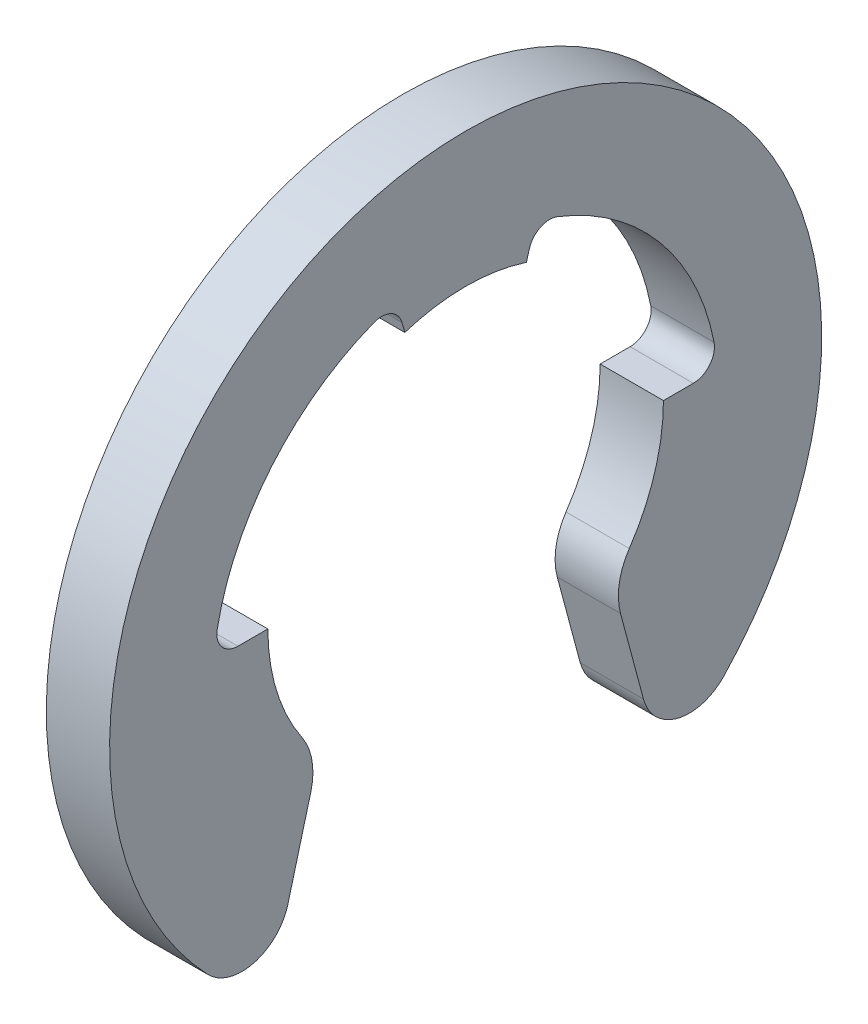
SolidWorks part; units mm, degrees
ref_plane "Plan1" through (0, 0, 0) normal (0, 0, 1) x (1, 0, 0)
ref_plane "Plan2" through (0, 0, 0) normal (0, 1, 0) x (1, 0, 0)
ref_plane "Plan3" through (0, 0, 0) normal (1, 0, 0) x (0, 0, -1)
sketch "Esquisse1" plane through (0, 0, 0) normal (1, 0, 0) x (0, 0, -1)
  line L0 (0, 0) -> (1.2452, -1.874) construction
  line L1 (0, 0) -> (0, -9.1601) construction
  line L2 (-20, 0) -> (20, 0) construction
  line L3 (0, 0) -> (0.6202, 2.1628) construction
  line L4 (-20, 0.15) -> (20, 0.15) construction
  line L5 (0.3841, 1.3395) -> (1.2452, -1.874) construction
  line L6 (0.3841, 1.3395) -> (0.4026, 1.404)
  line L7 (-1.25, 0.15) -> (-1.439, 0.15)
  line L8 (0.9789, -0.8802) -> (1.1238, -1.4209)
  line L9 (1.25, 0.15) -> (1.439, 0.15)
  line L10 (-0.9789, -0.8802) -> (-1.1238, -1.4209)
  line L11 (-0.3841, 1.3395) -> (-0.4026, 1.404)
  arc A0 (1.631, -1.5499) -> (-1.631, -1.5499) centre (0, 0) ccw
  arc A1 (1.5699, 0.3091) -> (0.579, 1.4916) centre (0, 0) ccw
  arc A2 (0.3841, 1.3395) -> (-0.3841, 1.3395) centre (0, 0.15) ccw
  arc A3 (1.25, 0.15) -> (1.0343, -0.552) centre (0, 0.15) cw
  arc A4 (1.631, -1.5499) -> (1.1238, -1.4209) centre (1.4135, -1.3433) cw
  arc A5 (0.579, 1.4916) -> (0.4026, 1.404) centre (0.5308, 1.3673) ccw
  arc A6 (1.5699, 0.3091) -> (1.439, 0.15) centre (1.439, 0.2833) cw
  arc A7 (-1.5699, 0.3091) -> (-1.439, 0.15) centre (-1.439, 0.2833) ccw
  arc A8 (-0.579, 1.4916) -> (-0.4026, 1.404) centre (-0.5308, 1.3673) cw
  arc A9 (-1.631, -1.5499) -> (-1.1238, -1.4209) centre (-1.4135, -1.3433) ccw
  arc A10 (-1.25, 0.15) -> (-1.0343, -0.552) centre (0, 0.15) ccw
  arc A11 (-1.5699, 0.3091) -> (-0.579, 1.4916) centre (0, 0) cw
  arc A12 (0.9789, -0.8802) -> (1.0343, -0.552) centre (1.3652, -0.7766) cw
  arc A13 (-0.9789, -0.8802) -> (-1.0343, -0.552) centre (-1.3652, -0.7766) ccw
  point P24 (0.441, 1.538)
  dimension "D1" = 2.25
  dimension "D2" = 0.15
  dimension "D3" = 1.6
  dimension "D4" = 0.3
  dimension "D7" = 0.4
  dimension "D8" = 16
  dimension "r" = 0.1333
  dimension "D9" = 15
extrude "Base-Extrusion" add sketch "Esquisse1" along normal blind 0.4
equation "\"r@Esquisse1\"=\"D1@Base-Extrusion\"/3"
